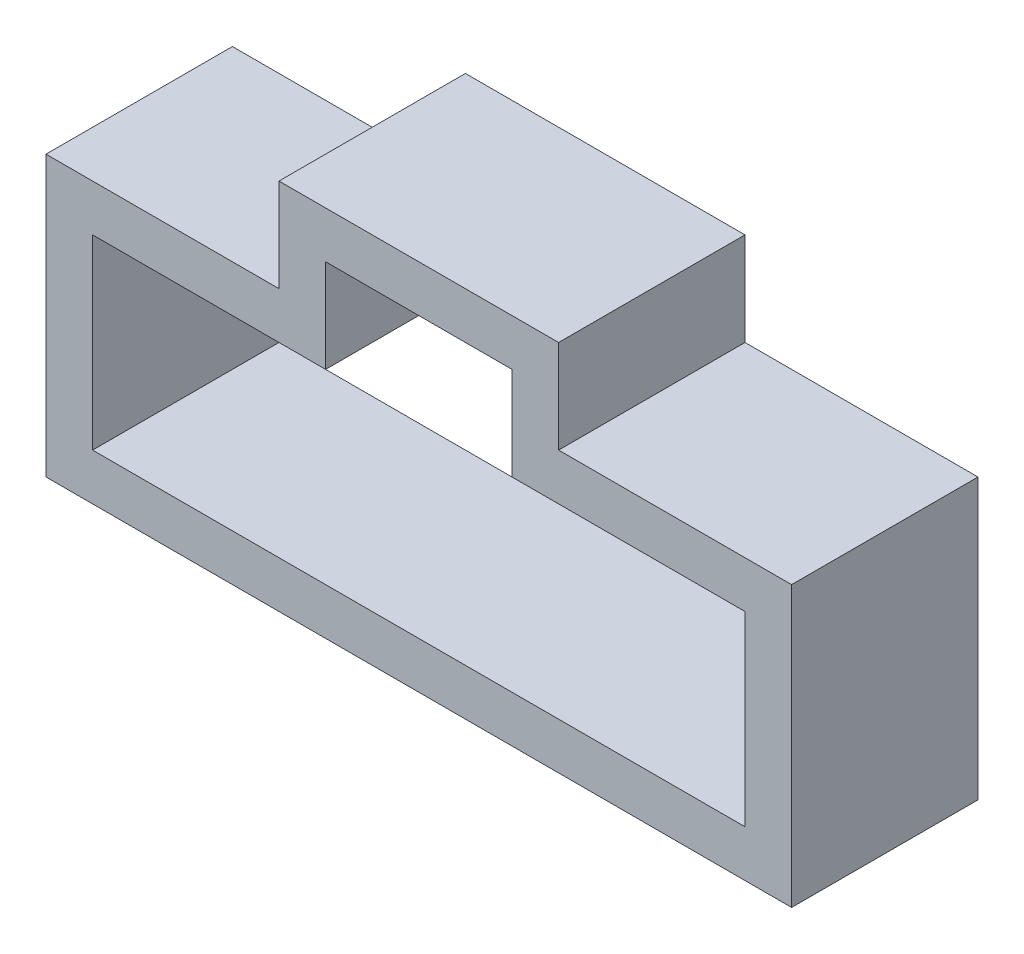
SolidWorks part; units mm, degrees
ref_plane "Front Plane" through (0, 0, 0) normal (0, 0, 1) x (1, 0, 0)
ref_plane "Top Plane" through (0, 0, 0) normal (0, 1, 0) x (1, 0, 0)
ref_plane "Right Plane" through (0, 0, 0) normal (1, 0, 0) x (0, 0, -1)
sketch "Sketch1" plane through (0, 0, 0) normal (0, 0, 1) x (1, 0, 0)
  line L0 (0, 0) -> (0, 25)
  line L1 (0, 25) -> (25, 25)
  line L2 (25, 25) -> (25, 35)
  line L3 (25, 35) -> (50, 35)
  line L4 (50, 35) -> (50, 25)
  line L5 (50, 25) -> (75, 25)
  line L6 (75, 25) -> (75, 0)
  line L7 (75, 0) -> (0, 0)
  dimension "D1" = 25
  dimension "D2" = 25
  dimension "D3" = 75
  dimension "D4" = 35
  dimension "D5" = 25
extrude "Extrude-Thin1" add sketch "Sketch1" along normal mid plane 20 thin
